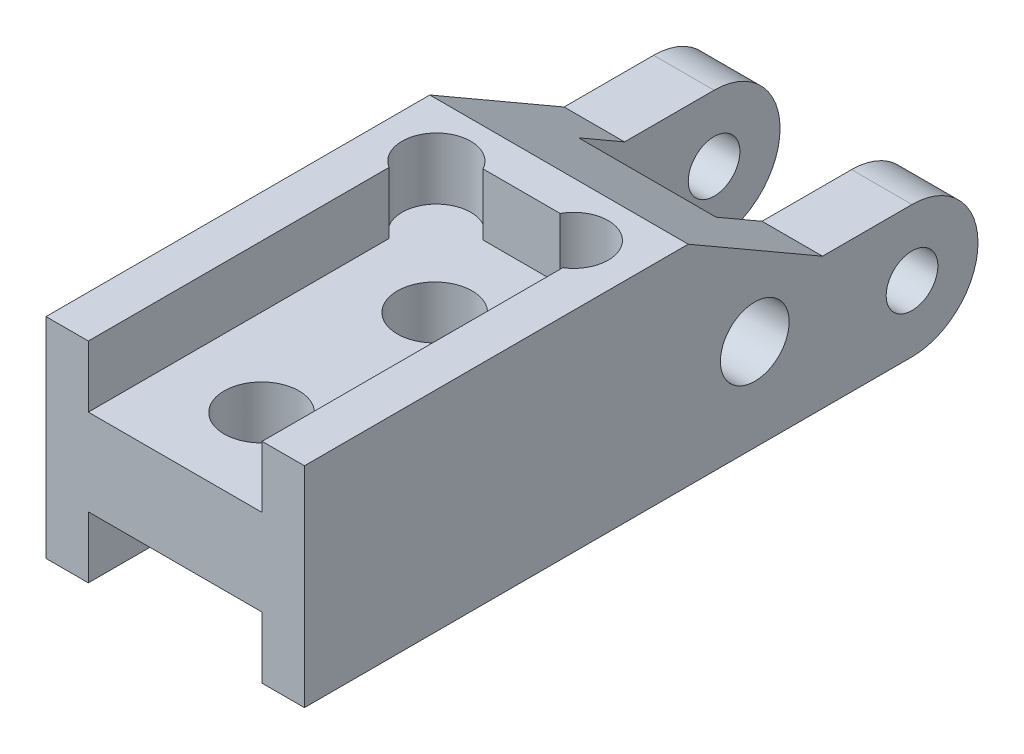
SolidWorks part; units mm, degrees
ref_plane "Front Plane" through (0, 0, 0) normal (0, 0, 1) x (1, 0, 0)
ref_plane "Top Plane" through (0, 0, 0) normal (0, 1, 0) x (1, 0, 0)
ref_plane "Right Plane" through (0, 0, 0) normal (1, 0, 0) x (0, 0, -1)
sketch "Sketch1" plane through (0, 0, 0) normal (0, 1, 0) x (1, 0, 0)
  line L0 (-5.969, 15.5575) -> (5.969, -15.5575) construction
  line L1 (-5.969, 15.5575) -> (5.969, 15.5575)
  line L2 (-5.969, 15.5575) -> (-5.969, -15.5575)
  line L3 (-5.969, -15.5575) -> (5.969, -15.5575)
  line L4 (5.969, 15.5575) -> (5.969, -15.5575)
  dimension "D1" = 11.938
  dimension "D2" = 31.115
extrude "Extrude1" add sketch "Sketch1" against normal mid plane 9.6774
sketch "Sketch2" plane through (0, 4.8387, 0) normal (0, 1, 0) x (1, 0, 0)
  line L0 (5.969, -15.5575) -> (5.969, 15.5575) construction
  line L1 (-5.969, 15.5575) -> (-5.969, -15.5575) construction
  line L3 (-5.969, -15.5575) -> (5.969, -15.5575) construction
  circle A0 centre (-3.175, -0.3175) radius 1.5875
  circle A1 centre (3.175, -0.3175) radius 1.5875
  dimension "D1" = 3.175
  dimension "D2" = 3.175
  dimension "D7" = 2.794
  dimension "D3" = 2.794
  dimension "D4" = 6.35
  dimension "D5" = 15.24
  dimension "D6" = 15.24
extrude "Cut-Extrude1" cut sketch "Sketch2" against normal blind 2.8448
sketch "Sketch3" plane through (0, 4.8387, 0) normal (0, 1, 0) x (-1, 0, 0)
  line L0 (5.969, -15.5575) -> (5.969, 15.5575) construction
  line L1 (4.0132, -0.4445) -> (-4.0132, -0.4445)
  line L2 (4.0132, -0.4445) -> (4.0132, 26.4316)
  line L3 (4.0132, 26.4316) -> (-4.0132, 26.4316)
  line L4 (-4.0132, -0.4445) -> (-4.0132, 26.4316)
  line L6 (-5.969, 15.5575) -> (-5.969, -15.5575) construction
  line L7 (5.969, 15.5575) -> (-5.969, 15.5575) construction
  dimension "D1" = 8.0264
  dimension "D2" = 26.8761
  dimension "D3" = 1.9558
  dimension "D4" = 16.002
  dimension "D5" = 1.9558
extrude "Cut-Extrude2" cut sketch "Sketch3" against normal blind 2.8448
hole_wizard "#8-32 Tapped Hole1" positions "Sketch8" profile "Sketch7" tap size "#8-32" standard "ANSI Inch"
sketch "Sketch8" plane through (0, -4.8387, 0) normal (0, -1, 0) x (1, 0, 0)
  line L0 (-5.969, 15.5575) -> (5.969, 15.5575) construction
  line L2 (5.969, 15.5575) -> (5.969, -15.5575) construction
  point P0 (0, 11.5697)
  point P1 (0, 3.5687)
  dimension "D1" = 8.001
  dimension "D2" = 3.9878
  dimension "D3" = 5.969
sketch "Sketch7" plane through (0, -4.8387, 11.5697) normal (1, 0, 0) x (0, 0, -1)
  line L0 (0, 0) -> (0, 9.6774)
  line L1 (0, 9.6774) -> (1.7272, 9.6774)
  line L2 (1.7272, 9.6774) -> (1.7272, 0)
  line L5 (1.7272, 0) -> (0, 0)
  line L11 (0, -6.35) -> (0, 107.95) construction
  dimension "Thru Tap Drill Dia." = 3.4544
  dimension "Thru Tap Drill Depth" = 9.6774
ref_plane "Plane5" through (0, 0, -15.5575) normal (0, 0, -1) x (-1, 0, 0)
sketch "Sketch15" plane through (0, 0, 0) normal (-1, 0, 0) x (0, 0, 1)
  line L0 (-15.5575, 4.8387) -> (15.5575, 4.8387) construction
  line L1 (-15.5575, -4.8387) -> (-10.4775, -4.8387)
  line L2 (-15.5575, -4.8387) -> (-15.5575, 4.8387)
  line L3 (-15.5575, 4.8387) -> (-4.8903, 4.8387)
  line L4 (-10.4775, -4.8387) -> (-4.8903, 4.8387)
  line L5 (-15.5575, -4.8387) -> (-15.5575, 4.8387) construction
  line L6 (-15.5575, -4.8387) -> (15.5575, -4.8387) construction
  dimension "D1" = 120
  dimension "D2" = 5.08
extrude "Cut-Extrude8" cut sketch "Sketch15" against normal mid plane 6.35
sketch "Sketch16" plane through (-5.969, 0, 0) normal (-1, 0, 0) x (0, 0, 1)
  line L0 (-15.5575, 4.8387) -> (15.5575, 4.8387) construction
  line L1 (-15.5575, 4.8387) -> (-2.1717, 4.8387)
  line L2 (-15.5575, 4.8387) -> (-15.5575, -1.7907)
  line L3 (-12.5095, 1.2573) -> (-8.3749, 1.2573)
  line L4 (-2.1717, 4.8387) -> (-8.3749, 1.2573)
  line L5 (-15.5575, -4.8387) -> (15.5575, -4.8387) construction
  line L6 (15.5575, -4.8387) -> (15.5575, 4.8387) construction
  arc A0 (-12.5095, 1.2573) -> (-15.5575, -1.7907) centre (-12.5095, -1.7907) ccw
  circle A1 centre (-12.5095, -1.7907) radius 1.1938
  dimension "D4" = 6.096
  dimension "D5" = 28.067
  dimension "D6" = 10.3378
  dimension "D7" = 2.3876
  dimension "D1" = 30
  dimension "D2" = 13.3858
  dimension "D3" = 3.5814
extrude "Cut-Extrude9" cut sketch "Sketch16" against normal through all
fillet "Fillet1" radius 3.048 2 edges at (4.572, -4.8387, -15.5575) (-4.572, -4.8387, -15.5575)
sketch "Sketch20" plane through (-5.969, 0, 0) normal (-1, 0, 0) x (0, 0, 1)
  line L0 (-12.5095, -4.8387) -> (15.5575, -4.8387) construction
  line L1 (15.5575, -4.8387) -> (15.5575, 4.8387) construction
  circle A0 centre (-5.2451, -0.5969) radius 1.5875
  dimension "D1" = 3.175
  dimension "D2" = 4.2418
  dimension "D3" = 20.8026
extrude "Cut-Extrude14" cut sketch "Sketch20" against normal through all
mirror "Mirror1" about plane through (0, 0, 0) normal (0, 1, 0) of "Cut-Extrude2", "Cut-Extrude1"
